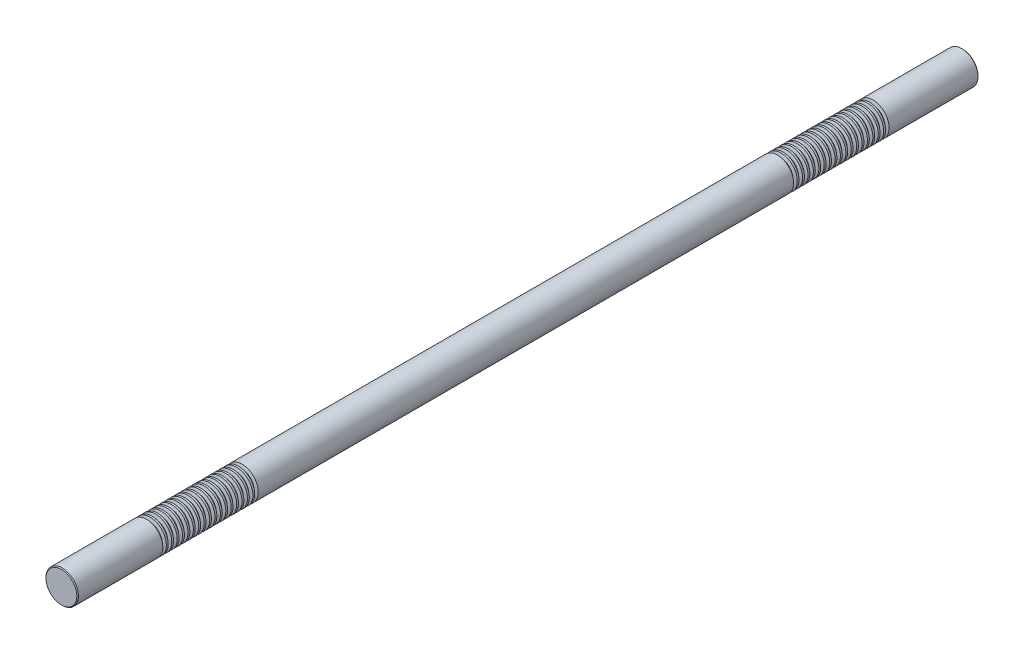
SolidWorks part; units mm, degrees
ref_plane "Front Plane" through (0, 0, 0) normal (0, 0, 1) x (1, 0, 0)
ref_plane "Top Plane" through (0, 0, 0) normal (0, 1, 0) x (1, 0, 0)
ref_plane "Right Plane" through (0, 0, 0) normal (1, 0, 0) x (0, 0, -1)
sketch "Sketch1" plane through (0, 0, 0) normal (0, 0, 1) x (1, 0, 0)
  circle A0 centre (0, 0) radius 18
  dimension "D1" = 36
extrude "Boss-Extrude1" add sketch "Sketch1" along normal mid plane 1000
chamfer "Chamfer1" distance 0.9 angle 45 2 edges at (18, 0, -500) (18, 0, 500)
sketch "Sketch2" plane through (0, 0, 0) normal (1, 0, 0) x (0, 0, -1)
  line L0 (400.4689, 18) -> (396.5311, 18)
  line L1 (499.1, 18) -> (-499.1, 18) construction
  line L2 (396.5311, 18) -> (397.4689, 14.5)
  line L3 (397.4689, 14.5) -> (399.5311, 14.5)
  line L4 (399.5311, 14.5) -> (400.4689, 18)
  line L5 (500, -17.1) -> (500, 17.1) construction
  point P4 (398.5, 18)
  point P7 (398.5, 14.5)
  point P8 (400, 16.25)
  point P9 (397, 16.25)
  dimension "D1" = 3
  dimension "D2" = 100
  dimension "D3" = 3.5
  dimension "D4" = 30
revolve "Cut-Revolve1" cut sketch "Sketch2" angle 360 about axis through (0, 0, 500) along (0, 0, -1)
pattern_linear "LPattern1" count 18 spacing 6 along (0, 0, 1) of "Cut-Revolve1"
pattern_linear "LPattern2" count 2 spacing 700 along (0, 0, 1) of "Cut-Revolve1", "LPattern1"
